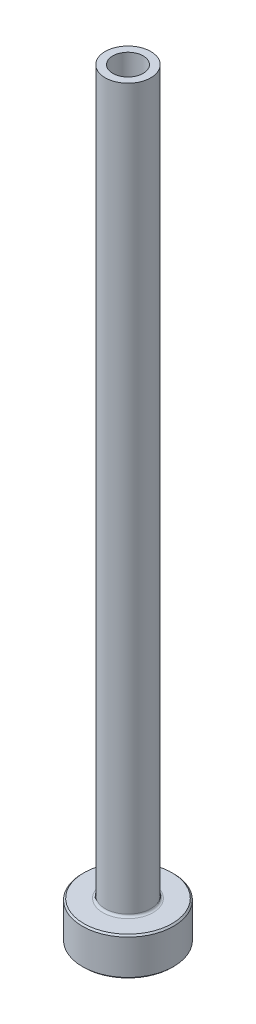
SolidWorks part; units mm, degrees
ref_plane "Front Plane" through (0, 0, 0) normal (0, 0, 1) x (1, 0, 0)
ref_plane "Top Plane" through (0, 0, 0) normal (0, 1, 0) x (1, 0, 0)
ref_plane "Right Plane" through (0, 0, 0) normal (1, 0, 0) x (0, 0, -1)
sketch "Sketch1" plane through (0, 0, 0) normal (0, 0, 1) x (1, 0, 0)
  line L0 (-2, 100) -> (-3, 100)
  line L1 (-3, 100) -> (-3, 5)
  line L2 (-3, 5) -> (-6, 5)
  line L3 (-6, 5) -> (-6, 0)
  line L4 (6.6, 0) -> (-6.6, 0) construction
  line L5 (-6, 0) -> (-2.25, 0)
  line L6 (-2, 55) -> (-2, 100)
  line L7 (0, 92.1877) -> (0, -15.5353) construction
  line L8 (0, -6.6) -> (0, 6.6) construction
  line L9 (-2, 55) -> (-2.25, 43)
  line L10 (-2.25, 43) -> (-2.25, 0)
  dimension "D1" = 0.25
  dimension "ID" = 4
  dimension "OD" = 6
  dimension "L" = 100
  dimension "H" = 12
  dimension "T" = 5
  dimension "N" = 45
  dimension "D2" = 12
revolve "Revolve1" add sketch "Sketch1" angle 360 about L7
fillet "Fillet1" radius 0.3 1 edges at (0, 5, 3)
chamfer "Chamfer1" distance 0.2 angle 45 2 edges at (0, 5, 6) (0, 0, 6)
chamfer "Chamfer3" distance 0.5 angle 45 1 edges at (0, 0, 2.25)
